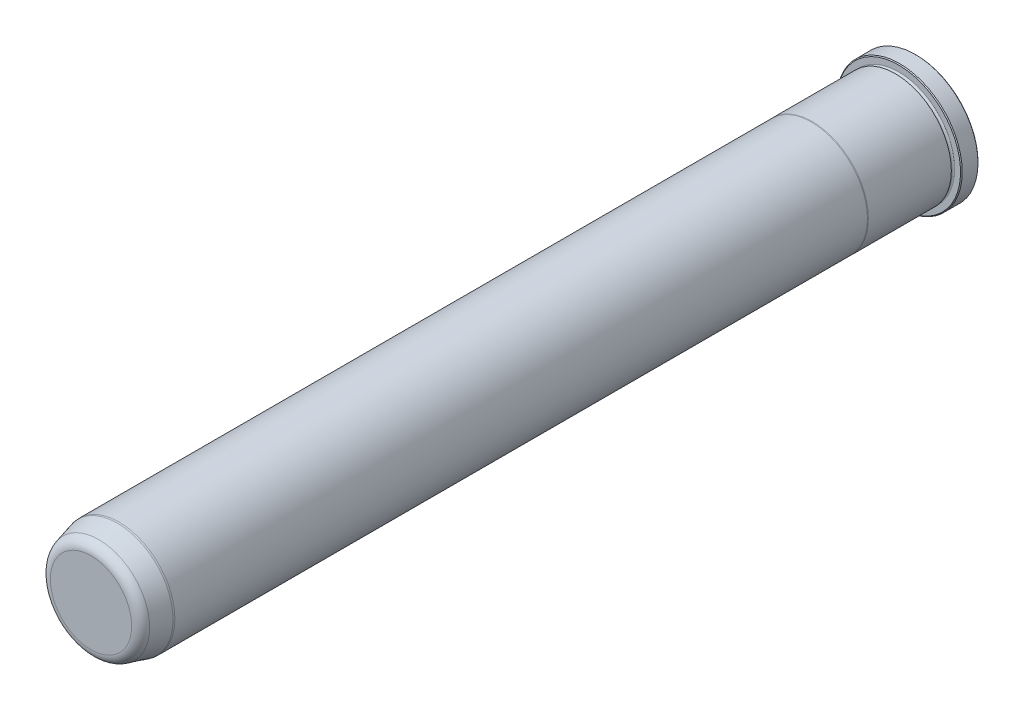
SolidWorks part; units mm, degrees
ref_plane "Front Plane" through (0, 0, 0) normal (0, 0, 1) x (1, 0, 0)
ref_plane "Top Plane" through (0, 0, 0) normal (0, 1, 0) x (1, 0, 0)
ref_plane "Right Plane" through (0, 0, 0) normal (1, 0, 0) x (0, 0, -1)
sketch "Sketch1" plane through (0, 0, 0) normal (1, 0, 0) x (0, 0, -1)
  line L0 (0, 0) -> (0, 28.448)
  line L1 (0, 28.448) -> (-7.9248, 28.448)
  line L2 (-7.9248, 28.448) -> (-7.9248, 25.3873)
  line L3 (-7.9248, 24.6253) -> (-9.4488, 24.6253) construction
  line L4 (-9.4488, 25.3873) -> (-9.4488, 25.4127)
  line L5 (-9.4488, 25.4127) -> (-47.1348, 25.4127)
  line L6 (-47.1348, 25.4127) -> (-47.498, 25.3873)
  line L7 (-47.498, 25.3873) -> (-361.95, 25.3873)
  line L9 (-374.65, 22.1219) -> (-374.65, 0)
  line L10 (-374.65, 0) -> (0, 0)
  line L11 (0, 0) -> (13.6287, 0) construction
  line L12 (-361.95, 25.3873) -> (-362.712, 25.3206)
  line L13 (-362.712, 25.3206) -> (-374.65, 22.1219)
  arc A0 (-9.4488, 25.3873) -> (-7.9248, 25.3873) centre (-8.6868, 25.3873) ccw
  dimension "D14" = 1.524
  dimension "D1" = 7.9248
  dimension "D2" = 1.524
  dimension "D3" = 56.896
  dimension "D4" = 50.8254
  dimension "D5" = 47.498
  dimension "D6" = 374.65
  dimension "D7" = 0.7874
  dimension "D8" = 4
  dimension "D9" = 50.7746
  dimension "D10" = 5
  dimension "D11" = 15
  dimension "D12" = 0.762
  dimension "D13" = 12.7
revolve "Revolve1" add sketch "Sketch1" angle 360 about L11
fillet "Fillet6" radius 4.7625 1 edges at (22.1219, 0, 374.65)
chamfer "Chamfer1" distance 0.381 angle 45 2 edges at (28.448, 0, 0) (28.448, 0, 7.9248)
